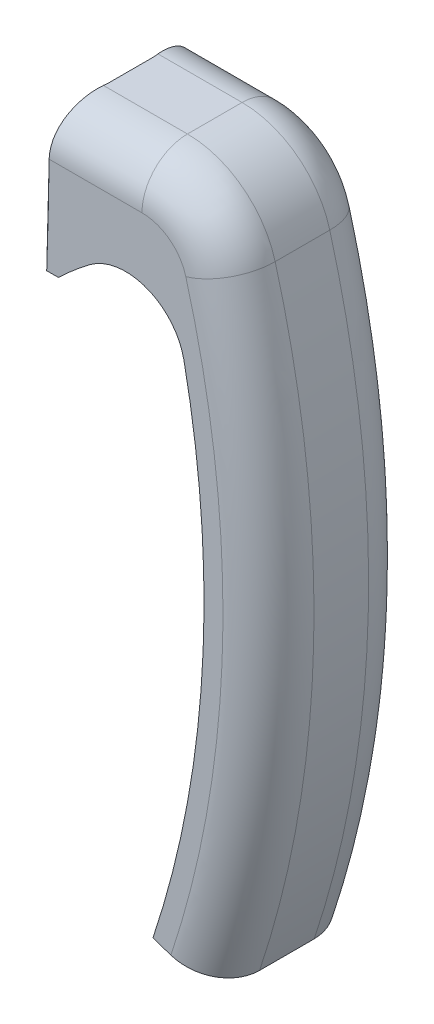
SolidWorks part; units mm, degrees
ref_plane "Front Plane" through (0, 0, 0) normal (0, 0, 1) x (1, 0, 0)
ref_plane "Top Plane" through (0, 0, 0) normal (0, 1, 0) x (1, 0, 0)
ref_plane "Right Plane" through (0, 0, 0) normal (1, 0, 0) x (0, 0, -1)
sketch "Sketch1" plane through (0, 0, 0) normal (0, 0, 1) x (1, 0, 0)
  line L0 (58.2008, 55.5777) -> (-222.2183, 148.7947) construction
  line L1 (45, 148.7947) -> (56.6721, 148.7947)
  line L2 (45, 148.7947) -> (-222.2183, 148.7947) construction
  line L3 (66.7355, 52.7406) -> (58.2008, 55.5777)
  line L5 (45, 128.7947) -> (45, 148.7947)
  arc A1 (68.9106, 139.4872) -> (56.6721, 148.7947) centre (56.6721, 136.0947) ccw
  arc A3 (66.7355, 52.7406) -> (68.9106, 139.4872) centre (-74.6689, 99.6869) ccw
  arc A5 (58.2008, 55.5777) -> (62.528, 127.5617) centre (-74.6689, 99.6869) ccw
  arc A7 (62.528, 127.5617) -> (49.4135, 132.5472) centre (54.3949, 125.9093) ccw
  arc A9 (49.4135, 132.5472) -> (45, 128.7947) centre (78.0052, 94.4476) ccw
  dimension "D1" = 148.9938
  dimension "D2" = 140
  dimension "D9" = 12.7
  dimension "D10" = 8.2992
  dimension "D12" = 47.6347
  dimension "D3" = 18.388
  dimension "D4" = 45
  dimension "D5" = 148.7947
  dimension "D6" = 99.6869
  dimension "D7" = 74.6689
  dimension "D8" = 222.2183
  dimension "D11" = 20
  dimension "D13" = 54.3471
extrude "Boss-Extrude1" add sketch "Sketch1" along normal mid plane 20.32
fillet "Fillet1" radius 6.35 6 edges at (74.278, 95.9521, -10.16) (64.3599, 146.2035, -10.16) (74.278, 95.9521, 10.16) (64.3599, 146.2035, 10.16) (50.8361, 148.7947, -10.16) (50.8361, 148.7947, 10.16)
sketch "Sketch2" plane through (45, 0, 0) normal (-1, 0, 0) x (0, 0, 1)
  line L4 (3.81, 148.7947) -> (-3.81, 148.7947)
  line L5 (-10.16, 142.4447) -> (-10.16, 128.7947)
  line L6 (-10.16, 128.7947) -> (10.16, 128.7947)
  line L7 (10.16, 128.7947) -> (10.16, 142.4447)
  line L8 (3.81, 148.7947) -> (-3.81, 148.7947)
  line L9 (-10.16, 142.4447) -> (-10.16, 128.7947)
  line L10 (-10.16, 128.7947) -> (10.16, 128.7947)
  line L11 (10.16, 128.7947) -> (10.16, 142.4447)
  arc A2 (-3.81, 148.7947) -> (-10.16, 142.4447) centre (-3.81, 142.4447) ccw
  arc A3 (10.16, 142.4447) -> (3.81, 148.7947) centre (3.81, 142.4447) ccw
  arc A4 (-3.81, 148.7947) -> (-10.16, 142.4447) centre (-3.81, 142.4447) ccw
  arc A5 (10.16, 142.4447) -> (3.81, 148.7947) centre (3.81, 142.4447) ccw
  dimension "D1" = 0
extrude "Boss-Extrude2" add sketch "Sketch2" along normal up to surface (1.6224 mm away)
